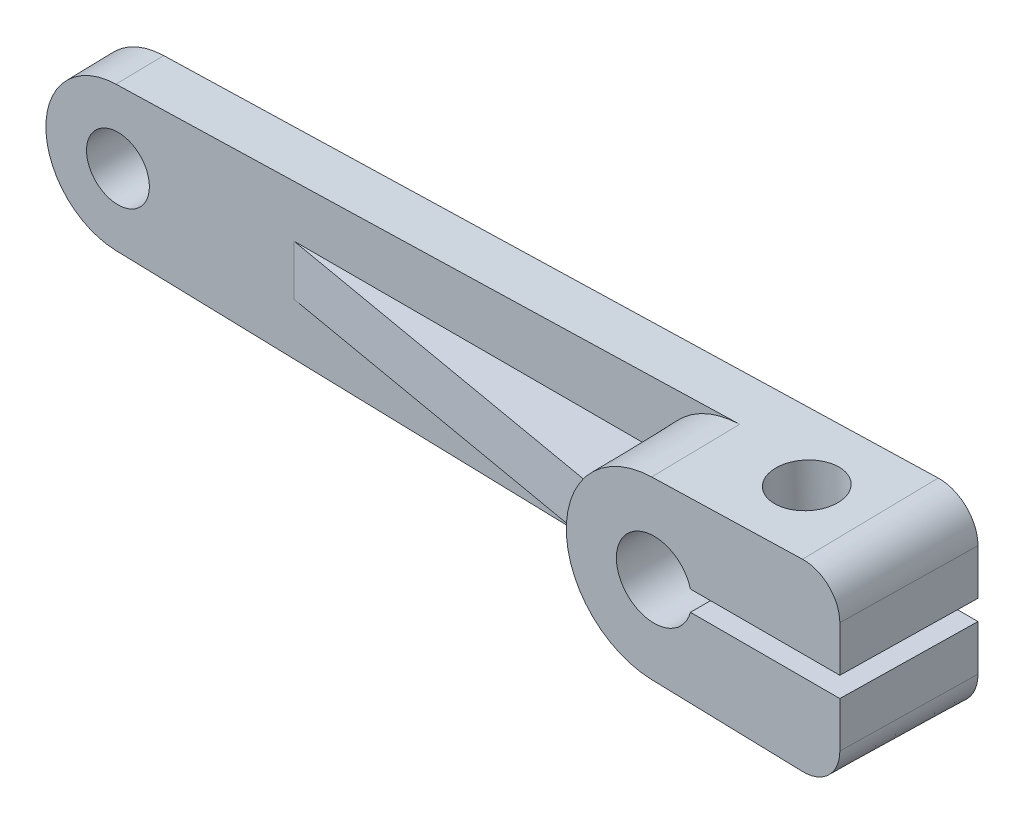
SolidWorks part; units mm, degrees
ref_plane "X" through (0, 0, 0) normal (0, 0, 1) x (1, 0, 0)
ref_plane "Y" through (0, 0, 0) normal (0, 1, 0) x (1, 0, 0)
ref_plane "Z" through (0, 0, 0) normal (1, 0, 0) x (0, 0, -1)
sketch "Esquisse1" plane through (0, 0, 0) normal (0, 0, 1) x (1, 0, 0)
  line L0 (0, 0) -> (87.2579, 0) construction
  line L1 (-0.0801, 2.8989) -> (30.7182, 3.75)
  line L2 (32.3, 2.2113) -> (32.3, -2.2113)
  line L3 (-0.0801, -2.8989) -> (30.7182, -3.75)
  arc A0 (-0.0801, 2.8989) -> (-0.0801, -2.8989) centre (0, 0) ccw
  arc A1 (30.7182, 3.75) -> (32.3, 2.2113) centre (30.7608, 2.2113) cw
  arc A2 (30.7182, -3.75) -> (32.3, -2.2113) centre (30.7608, -2.2113) ccw
  point P12 (32.3, 0)
  dimension "D2" = 2.9
  dimension "D3" = 35.2
  dimension "D4" = 1.5392
  dimension "D1" = 7.5
extrude "Base-Extrusion" add sketch "Esquisse1" along normal blind 1.9 draft 1
sketch "Esquisse2" plane through (0, 0, 1.9) normal (0, 0, 1) x (1, 0, 0)
  line L0 (0, 0) -> (25.0793, 0) construction
  line L3 (-0.0792, -2.8657) -> (30.7191, -3.7168)
  line L4 (32.2668, -2.2113) -> (32.2668, 2.2113)
  line L5 (30.7191, 3.7168) -> (-0.0792, 2.8657)
  line L6 (24.7212, -3.5511) -> (30.7191, -3.7168)
  line L7 (32.2668, -2.2113) -> (32.2668, 2.2113)
  line L8 (30.7191, 3.7168) -> (24.7212, 3.5511)
  arc A0 (24.7212, 3.5511) -> (24.7212, -3.5511) centre (24.8193, 0) ccw
  arc A3 (-0.0792, 2.8657) -> (-0.0792, -2.8657) centre (0, 0) ccw
  arc A4 (30.7191, -3.7168) -> (32.2668, -2.2113) centre (30.7608, -2.2113) ccw
  arc A5 (32.2668, 2.2113) -> (30.7191, 3.7168) centre (30.7608, 2.2113) ccw
  arc A7 (30.7191, -3.7168) -> (32.2668, -2.2113) centre (30.7608, -2.2113) ccw
  arc A8 (32.2668, 2.2113) -> (30.7191, 3.7168) centre (30.7608, 2.2113) ccw
  dimension "D2" = 11
  dimension "D1" = 0
extrude "Boss.-Extru.1" add sketch "Esquisse2" along normal blind 3.5 draft 1
sketch "Esquisse3" plane through (0, 0, 5.4) normal (0, 0, 1) x (1, 0, 0)
  line L0 (24.8193, 0) -> (33.0728, 0) construction
  line L1 (26.265, 0.4) -> (32.3, 0.4)
  line L2 (26.265, -0.4) -> (32.3, -0.4)
  line L4 (32.3, 2.2113) -> (32.3, -2.2113) construction
  line L5 (32.3, 0.4) -> (32.3, -0.4)
  arc A0 (26.265, 0.4) -> (26.265, -0.4) centre (24.8193, 0) ccw
  circle A1 centre (0, 0) radius 1.25
  dimension "D1" = 3
  dimension "D2" = 2.5
  dimension "D3" = 0.8
extrude "Enlèv. mat.-Extru.1" cut sketch "Esquisse3" against normal through all
sketch "Esquisse4" plane through (0, 0, 0) normal (0, 1, 0) x (1, 0, 0)
  line L0 (7, -1.9) -> (21.3105, -4.4)
  line L1 (-0.0792, -1.9) -> (24.7212, -1.9) construction
  line L2 (21.2668, -1.9) -> (21.3279, -5.4) construction
  dimension "D1" = 7
  dimension "D2" = 2.5
rib "Nervure2" sketch "Esquisse4" sketch "Esquisse4" thickness 2 extrusion direction parallel to sketch draft on no parameters "D1"=2
sketch "Esquisse5" plane through (-0.0801, 2.898, 0.0506) normal (-0.0276, 0.9995, 0.0175) x (-0.9996, -0.0276, -0.0005)
  line L0 (0, -0.0506) -> (-30.8101, -0.0655) construction
  circle A0 centre (-28.3308, 2.6857) radius 1.25
  dimension "D1" = 2.5
  dimension "D2" = 2.75
extrude "Enlèv. mat.-Extru.2" cut sketch "Esquisse5" against normal through all
